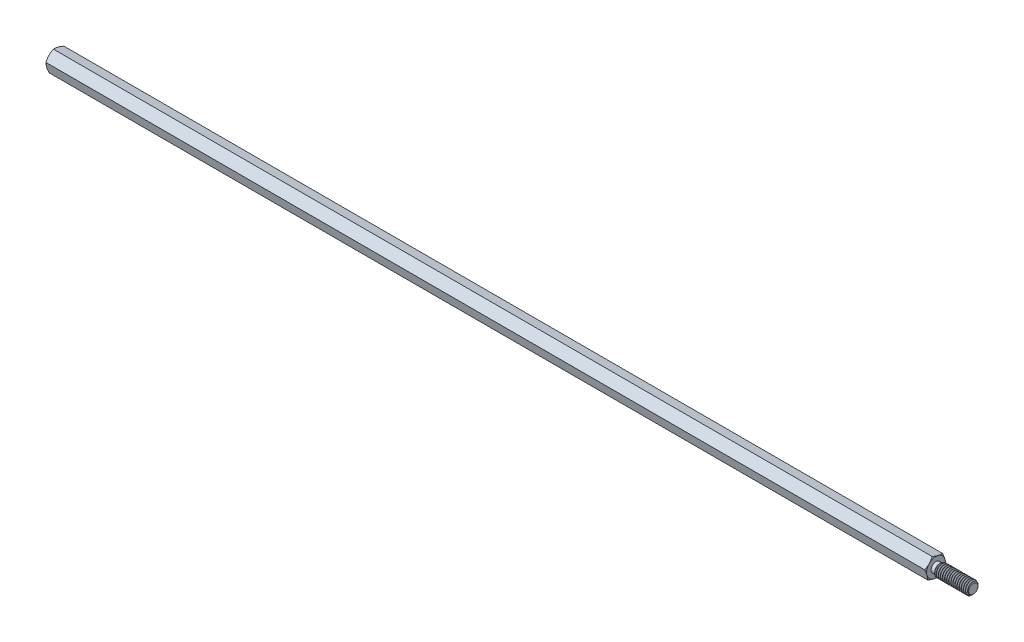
SolidWorks part; units mm, degrees
other "<STANDOFF-M3X0.5-212-MF>-<Tap Drill for M3x0.5 Tap2>"
ref_plane "Front Plane" through (0, 0, 0) normal (0, 0, 1) x (1, 0, 0)
ref_plane "Top Plane" through (0, 0, 0) normal (0, 1, 0) x (1, 0, 0)
ref_plane "Right Plane" through (0, 0, 0) normal (1, 0, 0) x (0, 0, -1)
inserted part "STANDOFF-M3X0.5-212-MF"
